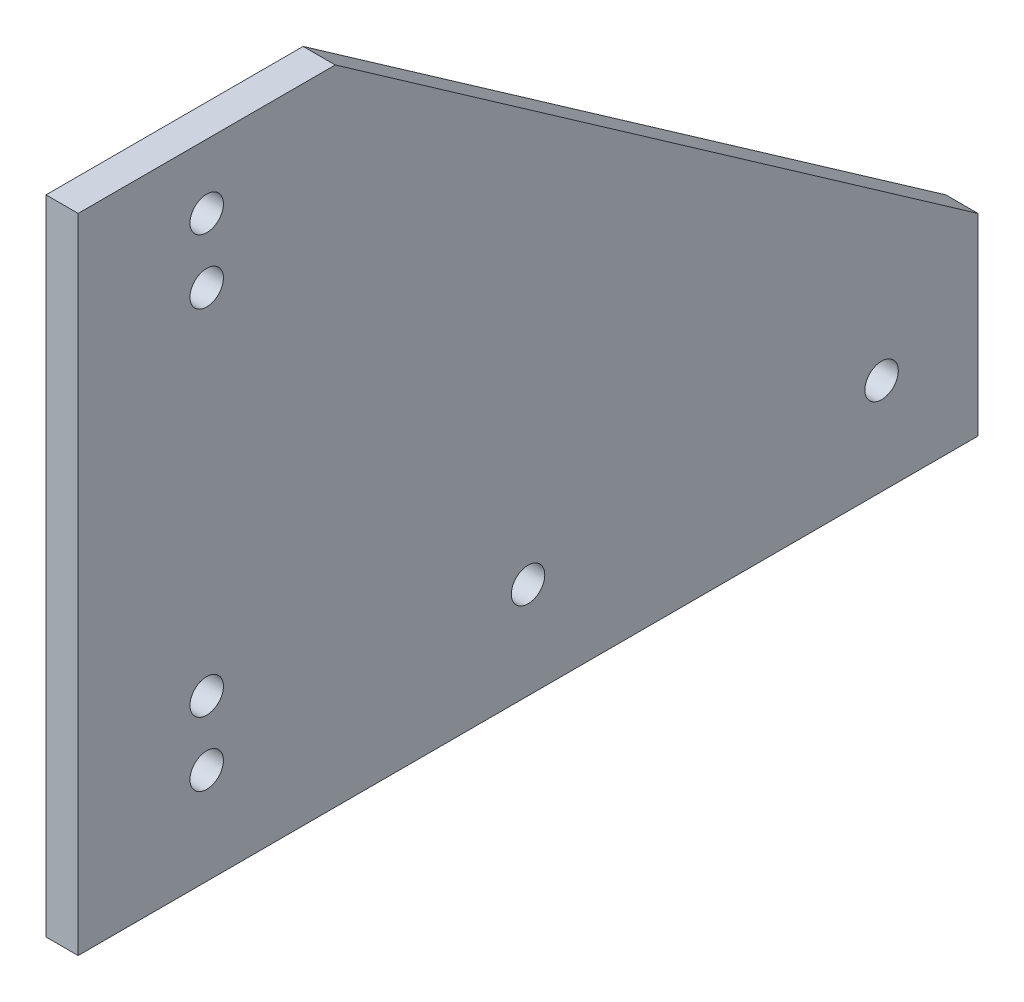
SolidWorks part; units mm, degrees
ref_plane "Front Plane" through (0, 0, 0) normal (0, 0, 1) x (1, 0, 0)
ref_plane "Top Plane" through (0, 0, 0) normal (0, 1, 0) x (1, 0, 0)
ref_plane "Right Plane" through (0, 0, 0) normal (1, 0, 0) x (0, 0, -1)
sketch "Sketch1" plane through (0, 0, 0) normal (1, 0, 0) x (0, 0, -1)
  line L0 (0, 0) -> (0, 127)
  line L1 (0, 0) -> (177.8, 0)
  line L2 (177.8, 0) -> (177.8, 38.1)
  line L3 (0, 127) -> (50.8, 127)
  line L4 (177.8, 38.1) -> (50.8, 127)
  dimension "D1" = 127
  dimension "D2" = 177.8
  dimension "D3" = 38.1
  dimension "D4" = 50.8
extrude "Boss-Extrude1" add sketch "Sketch1" along normal blind 6.35
sketch "Sketch2" plane through (6.35, 0, 0) normal (1, 0, 0) x (0, 0, -1)
  line L0 (0, 0) -> (177.8, 0) construction
  circle A0 centre (25.4, 114.3) radius 3.302
  circle A1 centre (25.4, 101.6) radius 3.302
  circle A2 centre (25.4, 19.05) radius 3.302
  circle A3 centre (25.4, 31.75) radius 3.302
  circle A4 centre (158.75, 19.05) radius 3.302
  circle A5 centre (88.9, 19.05) radius 3.302
  dimension "D1" = 6.604
  dimension "D6" = 12.7
  dimension "D2" = 19.05
  dimension "D3" = 19.05
  dimension "D4" = 12.7
  dimension "D5" = 101.6
  dimension "D7" = 158.75
  dimension "D8" = 88.9
extrude "bolts" cut sketch "Sketch2" against normal through all
